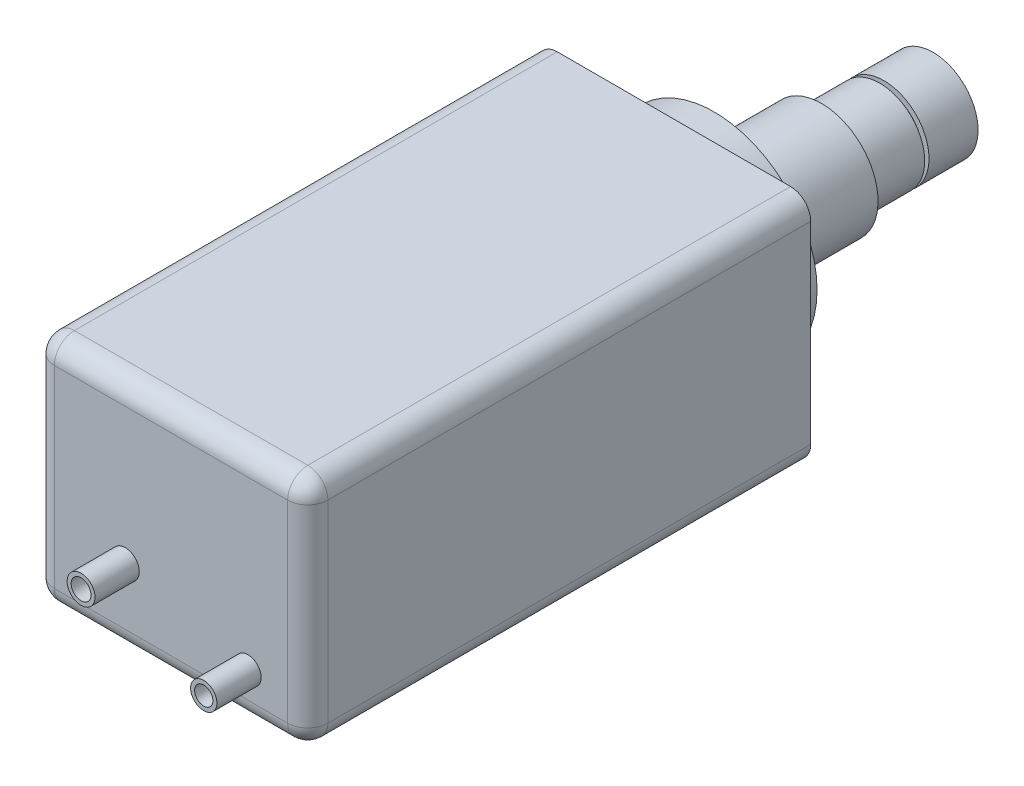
SolidWorks part; units mm, degrees
ref_plane "Plan de face" through (0, 0, 0) normal (0, 0, 1) x (1, 0, 0)
ref_plane "Plan de dessus" through (0, 0, 0) normal (0, 1, 0) x (1, 0, 0)
ref_plane "Plan de droite" through (0, 0, 0) normal (1, 0, 0) x (0, 0, -1)
sketch "Esquisse1" plane through (0, 0, 0) normal (0, 0, 1) x (1, 0, 0)
  line L0 (0, 0) -> (0, 51.9759) construction
  line L1 (-34, 29) -> (34, 29)
  line L2 (-34, 29) -> (-34, -29)
  line L3 (-34, -29) -> (34, -29)
  line L4 (34, 29) -> (34, -29)
  line L5 (0, 0) -> (86.6077, 0) construction
  dimension "D1" = 68
  dimension "D2" = 58
extrude "Boss.-Extru.1" add sketch "Esquisse1" along normal blind 125
fillet "Congé1" radius 5 4 edges at (-34, -29, 62.5) (34, -29, 62.5) (-34, 29, 62.5) (34, 29, 62.5)
fillet "Congé2" radius 5 8 edges at (-32.5355, 27.5355, 125) (0, 29, 125) (32.5355, 27.5355, 125) (34, 0, 125) (32.5355, -27.5355, 125) (0, -29, 125) (-32.5355, -27.5355, 125) (-34, 0, 125)
sketch "Esquisse2" plane through (0, 0, 0) normal (0, 0, -1) x (-1, 0, 0)
  circle A0 centre (0, 0) radius 25.5752
extrude "Boss.-Extru.2" add sketch "Esquisse2" along normal blind 10
sketch "Esquisse3" plane through (0, 0, 0) normal (0, 1, 0) x (1, 0, 0)
  line L0 (0, 10) -> (-14.0394, 10)
  line L1 (25.5752, 10) -> (-25.5752, 10) construction
  line L2 (-14.0394, 10) -> (-14.0394, 36.6945)
  line L3 (-14.0394, 36.6945) -> (-11.198, 36.6945)
  line L4 (-11.198, 36.6945) -> (-11.198, 51.1349)
  line L5 (-11.198, 51.1349) -> (-9.7547, 51.1349)
  line L6 (-9.7547, 51.1349) -> (-9.7547, 52.1986)
  line L7 (-9.7547, 52.1986) -> (-11.198, 52.1986)
  line L8 (-11.198, 52.1986) -> (-11.198, 64.3967)
  line L9 (-11.198, 64.3967) -> (0, 64.3967)
  line L10 (0, 64.3967) -> (0, 10)
revolve "Révolution1" add sketch "Esquisse3" angle 360 about L10
sketch "Esquisse4" plane through (0, -29, 0) normal (0, -1, 0) x (1, 0, 0)
  line L0 (-29, 0) -> (29, 0) construction
  line L1 (19.5, 0) -> (-19.5, 0)
  line L2 (19.5, 0) -> (19.5, 35.586)
  line L3 (19.5, 48) -> (-19.5, 48) construction
  line L4 (-19.5, 0) -> (-19.5, 35.586)
  line L5 (0, 0) -> (0, 69.8611) construction
  arc A0 (19.5, 35.586) -> (-19.5, 35.586) centre (0, 26.4777) ccw
  dimension "D1" = 48
  dimension "D2" = 39
extrude "Boss.-Extru.3" add sketch "Esquisse4" along normal blind 13 draft 11
sketch "Esquisse5" plane through (0, -42, 0) normal (0, -1, 0) x (1, 0, 0)
  line L0 (0, 0) -> (0, 60.0563) construction
  line L1 (-25.5752, 0) -> (25.5752, 0) construction
  circle A0 centre (0, 40) radius 2
  circle A1 centre (0, 22) radius 2
  dimension "D1" = 4
  dimension "D3" = 18
  dimension "D2" = 22
extrude "Enlèv. mat.-Extru.1" cut sketch "Esquisse5" against normal blind 15
sketch "Esquisse6" plane through (0, 0, 125) normal (0, 0, 1) x (1, 0, 0)
  circle A0 centre (-11.3433, -9.8576) radius 3.4674
  circle A1 centre (19.1475, -17.4803) radius 3.2719
extrude "Extru.-Mince1" add sketch "Esquisse6" along normal blind 11 thin
ref_plane "Plan1" through (0, 0, 185) normal (0, 0, 1) x (1, 0, 0)
